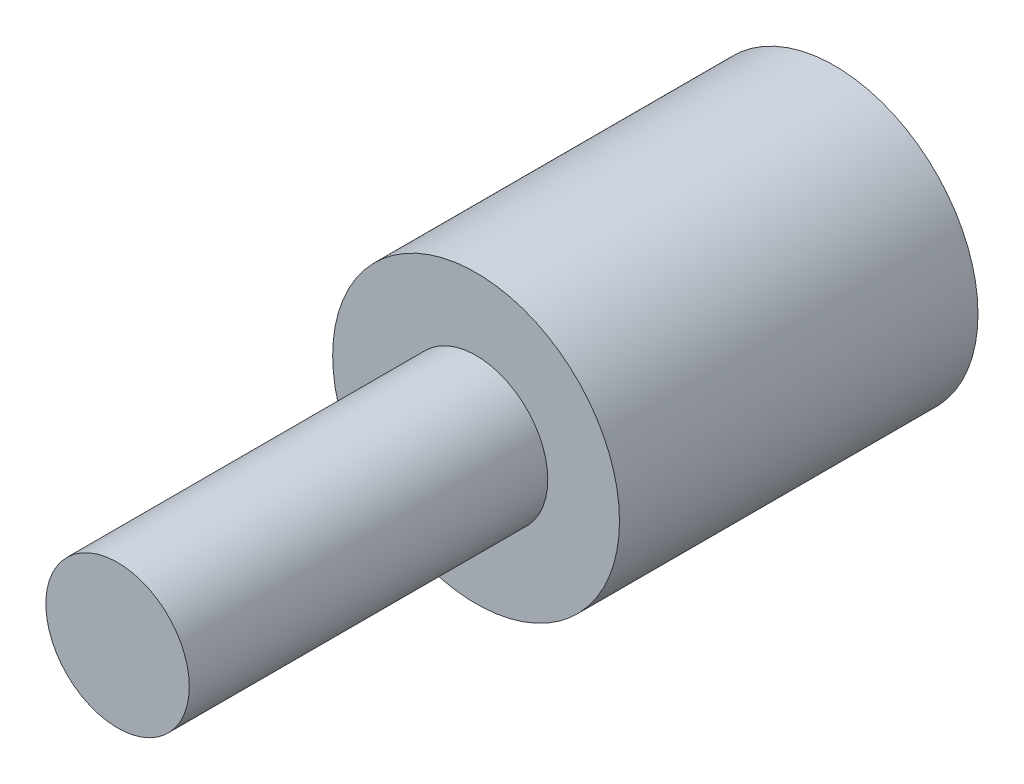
SolidWorks part; units mm, degrees
ref_plane "Front Plane" through (0, 0, 0) normal (0, 0, 1) x (1, 0, 0)
ref_plane "Top Plane" through (0, 0, 0) normal (0, 1, 0) x (1, 0, 0)
ref_plane "Right Plane" through (0, 0, 0) normal (1, 0, 0) x (0, 0, -1)
sketch "Sketch1" plane through (0, 0, 0) normal (1, 0, 0) x (0, 0, -1)
  line L0 (0, 0) -> (150, 0)
  line L1 (150, 0) -> (150, 30)
  line L4 (150, 30) -> (75, 30)
  line L5 (75, 30) -> (75, 15)
  line L6 (75, 15) -> (0, 15)
  line L7 (0, 15) -> (0, 0)
  dimension "D1" = 150
  dimension "D2" = 75
  dimension "D3" = 15
  dimension "D4" = 30
revolve "Revolve1" add sketch "Sketch1" angle 360 about L0
sketch "Sketch2" plane through (0, 0, -150) normal (0, 0, -1) x (-1, 0, 0)
  circle A0 centre (0, 0) radius 20
  dimension "D1" = 40
extrude "Cut-Extrude1" cut sketch "Sketch2" against normal blind 20
